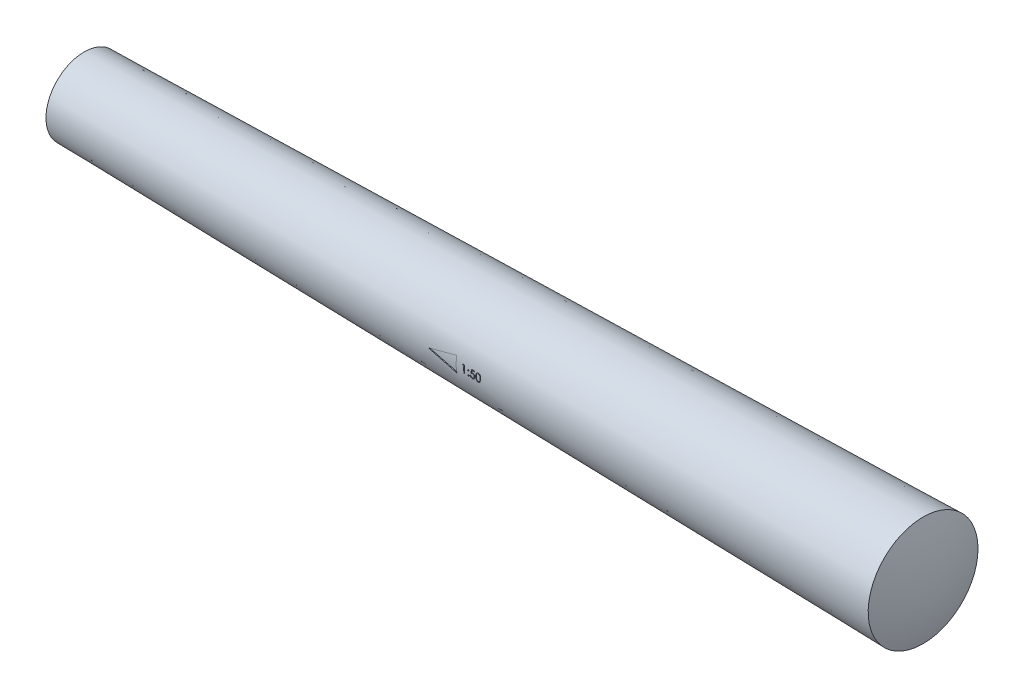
SolidWorks part; units mm, degrees
ref_plane "Front Plane" through (0, 0, 0) normal (0, 0, 1) x (1, 0, 0)
ref_plane "Top Plane" through (0, 0, 0) normal (0, 1, 0) x (1, 0, 0)
ref_plane "Right Plane" through (0, 0, 0) normal (1, 0, 0) x (0, 0, -1)
sketch "Sketch1" plane through (0, 0, 0) normal (1, 0, 0) x (0, 0, -1)
  circle A0 centre (0, 0) radius 5
  dimension "D1" = 10
extrude "Extrude1" add sketch "Sketch1" along normal mid plane 110
draft "Draft1" type of draft neutral plane draft angle 1.146 faces to draft 1 parameters "D1"=1.146
sketch "Sketch2" plane through (0, 0, 0) normal (0, 0, 1) x (1, 0, 0)
  line L0 (-55, 0) -> (-55, 5)
  line L1 (-55, 5) -> (-55, -5) construction
  line L2 (-55, 0) -> (-56.2, 0)
  line L3 (-56.2, 0) -> (-56.2, -6.1) construction
  line L4 (55, 0) -> (55, 7.2001)
  line L5 (55, -7.2001) -> (55, 7.2001) construction
  line L6 (55, 0) -> (56.2, 0)
  line L7 (56.2, 0) -> (56.2, -6.1) construction
  line L8 (-55, -5) -> (55, -7.2001) construction
  arc A0 (-56.2, 0) -> (-55, 5) centre (-45.1833, 0) cw
  arc A1 (56.2, 0) -> (55, 7.2001) centre (33.9996, 0) ccw
  point P14 (0, -6.1)
revolve "Revolve1" add sketch "Sketch2" angle 360 about L2
sketch "Sketch5" plane through (0, 0, 0) normal (0, 0, 1) x (1, 0, 0)
  line L0 (0, 6.1) -> (0, -6.1) construction
  line L1 (55, 7.2001) -> (-55, 5) construction
  line L2 (-55, -5) -> (55, -7.2001) construction
ref_plane "Plane2" through (0, 0, 0) normal (-0.02, 0, 0.9998) x (0.9998, 0, 0.02)
sketch "Sketch6" plane through (0, 0, 0) normal (-0.02, 0, 0.9998) x (0.9998, 0, 0.02)
  line L0 (0, 0) -> (0, 1)
  line L1 (0, 6.1) -> (0, -6.1) construction
  line L2 (0, 1) -> (-3.7321, 0)
  line L3 (-3.7321, 0) -> (0, -1)
  line L4 (0, -1) -> (0, 0)
  line L5 (0, -0.5) -> (4, -0.5) construction
  text T0 "1:50" font "Century Gothic" height 1
  dimension "D1" = 2
  dimension "D2" = 30
  dimension "D3" = 4
wrap "Wrap2" sketch "Sketch6" wrap type deboss source sketch "Sketch6" thickness 0.1 parameters "D1"=0.1
equation "\"D2@Sketch2\" = \"D1@Sketch2\""
